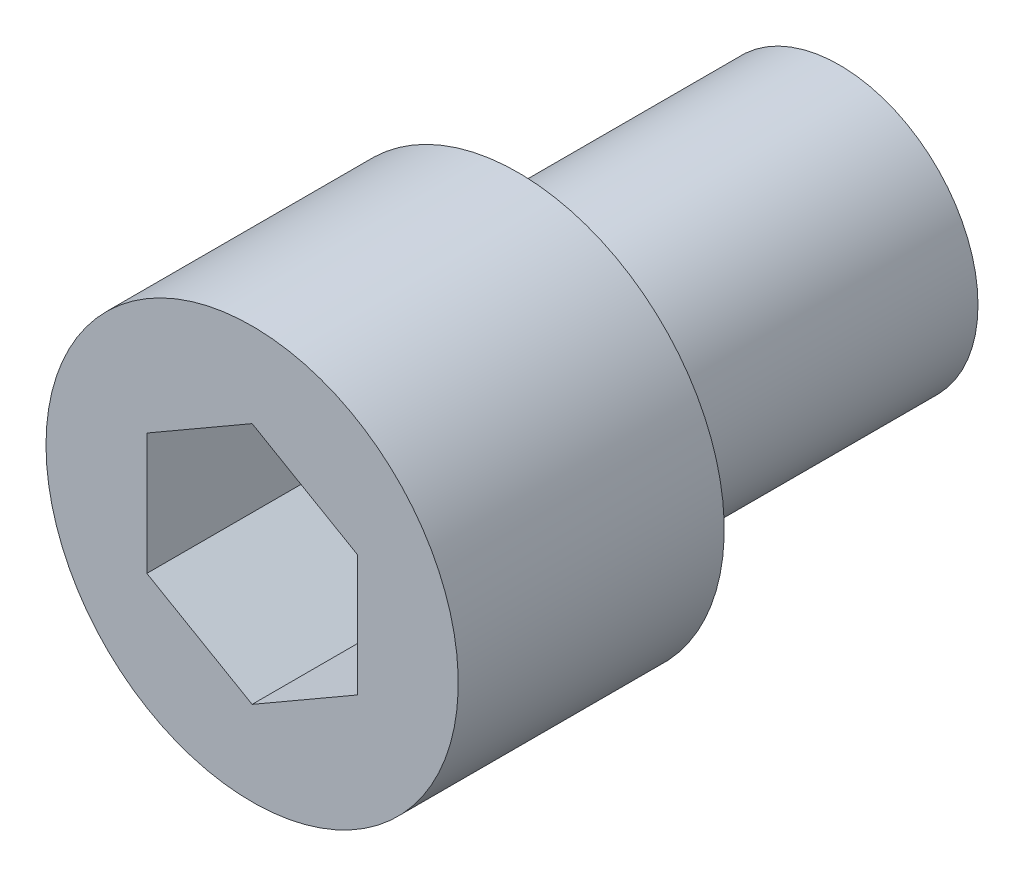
SolidWorks part; units mm, degrees
ref_plane "Plane1" through (0, 0, 0) normal (0, 0, 1) x (1, 0, 0)
ref_plane "Plane2" through (0, 0, 0) normal (0, 1, 0) x (1, 0, 0)
ref_plane "Plane3" through (0, 0, 0) normal (1, 0, 0) x (0, 0, -1)
sketch "Sketch1" plane through (0, 0, 0) normal (0, 0, 1) x (1, 0, 0)
  circle A0 centre (0, 0) radius 3.175
  dimension "D1" = 6.35
extrude "Base-Extrude" add sketch "Sketch1" along normal blind 7.366
sketch "Sketch2" plane through (0, 0, 7.366) normal (0, 0, 1) x (1, 0, 0)
  circle A0 centre (0, 0) radius 4.7244
  dimension "D1" = 9.4488
extrude "Boss-Extrude1" add sketch "Sketch2" along normal blind 6.096
sketch "Sketch5" plane through (0, 0, 13.462) normal (0, 0, 1) x (1, 0, 0)
  line L0 (0, 2.7863) -> (2.413, 1.3931)
  line L1 (2.413, 1.3931) -> (2.413, -1.3931)
  line L2 (2.413, -1.3931) -> (0, -2.7863)
  line L3 (0, -2.7863) -> (-2.413, -1.3931)
  line L4 (-2.413, -1.3931) -> (-2.413, 1.3931)
  line L5 (-2.413, 1.3931) -> (0, 2.7863)
extrude "Cut-Extrude1" cut sketch "Sketch5" against normal blind 3.556
sketch "Sketch6" plane through (0, 0, 0) normal (0, 0, -1) x (-1, 0, 0)
  circle A0 centre (0, 0) radius 1.5875
  dimension "D1" = 3.175
extrude "Cut-Extrude2" cut sketch "Sketch6" against normal through all
